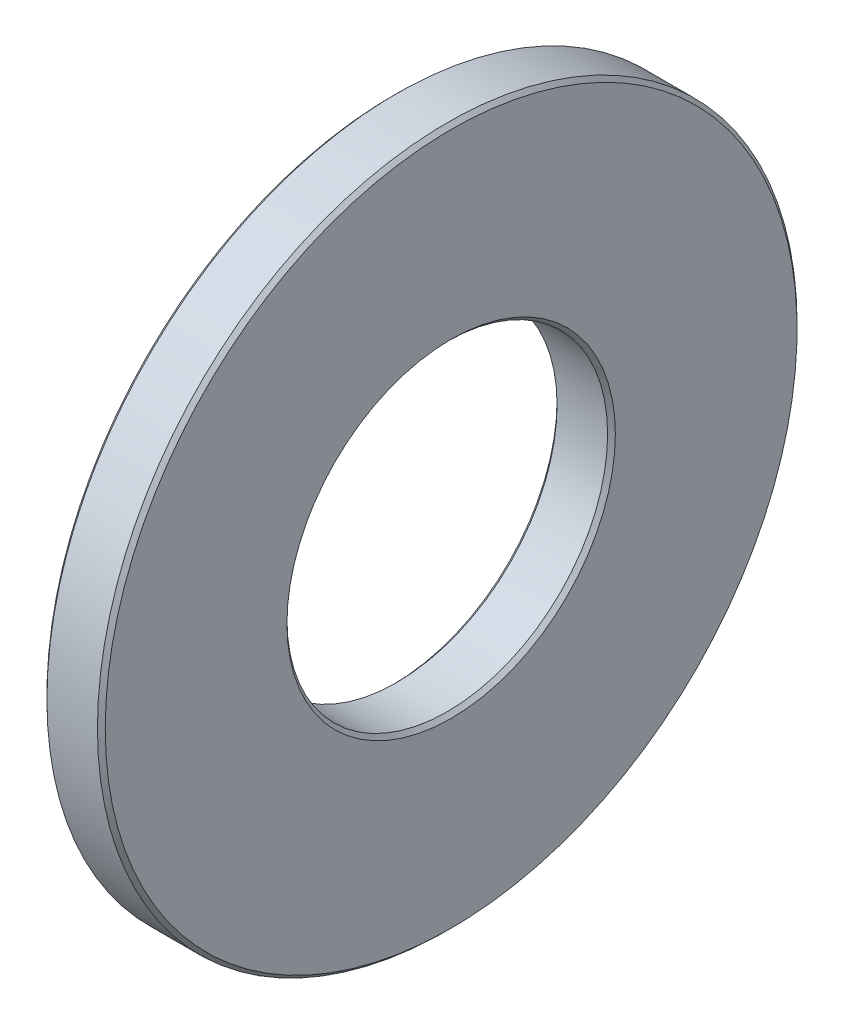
SolidWorks part; units mm, degrees
ref_plane "Face" through (0, 0, 0) normal (0, 0, 1) x (1, 0, 0)
ref_plane "Dessus" through (0, 0, 0) normal (0, 1, 0) x (1, 0, 0)
ref_plane "Droite" through (0, 0, 0) normal (1, 0, 0) x (0, 0, -1)
sketch "Esquisse1" plane through (0, 0, 0) normal (0, 0, 1) x (1, 0, 0)
  line L0 (0, 0) -> (20.1631, 0) construction
  line L2 (0, 4.125) -> (1.5, 4.125)
  line L3 (0, 4.125) -> (0, 9)
  line L4 (0, 9) -> (1.5, 9)
  line L5 (1.5, 4.125) -> (1.5, 9)
  dimension "D1" = 8.25
  dimension "D2" = 9
  dimension "D3" = 1.5
revolve "Base-Révolution" add sketch "Esquisse1" angle 360 about L0
chamfer "Chanfrein1" distance 0.1 angle 45 4 edges at (0, 0, 4.125) (1.5, 0, 4.125) (1.5, 0, 9) (0, 0, 9)
